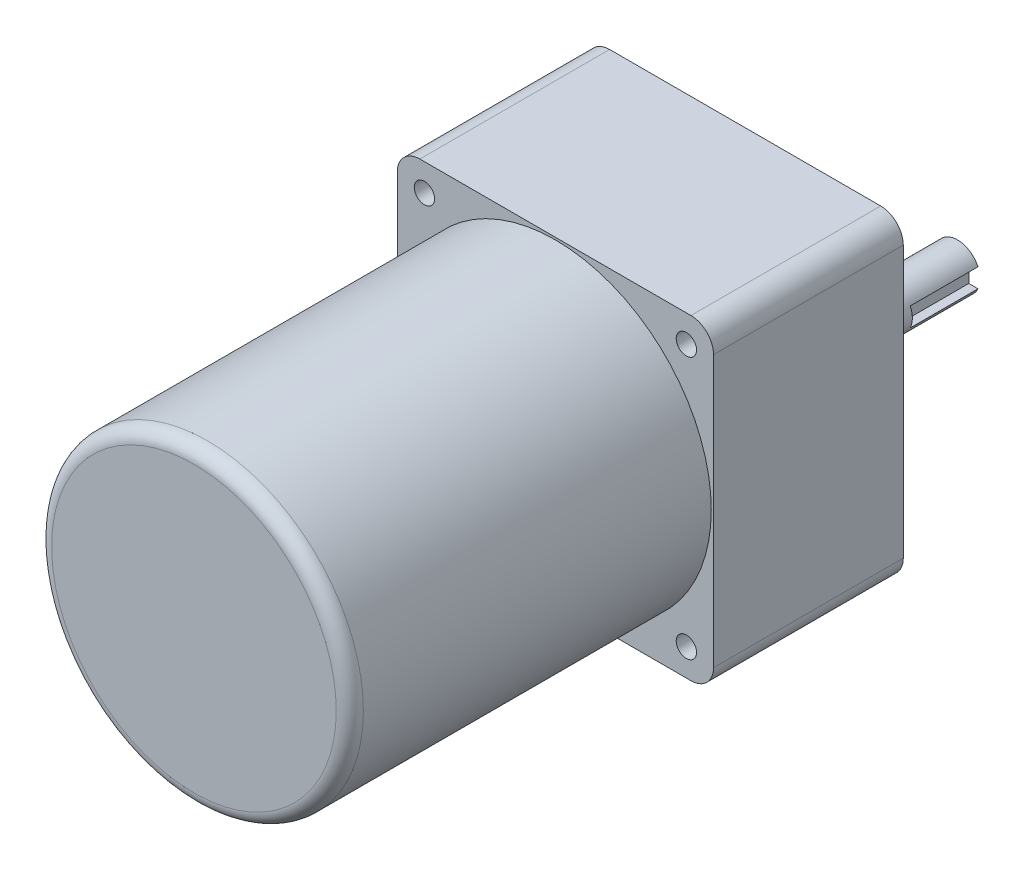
SolidWorks part; units mm, degrees
ref_plane "前基準面" through (0, 0, 0) normal (0, 0, 1) x (1, 0, 0)
ref_plane "上基準面" through (0, 0, 0) normal (0, 1, 0) x (1, 0, 0)
ref_plane "右基準面" through (0, 0, 0) normal (1, 0, 0) x (0, 0, -1)
sketch "草圖1" plane through (0, 0, 0) normal (0, 0, 1) x (1, 0, 0)
  line L1 (-35, -30) -> (-35, 30)
  line L2 (35, -30) -> (35, 30)
  line L3 (30, 35) -> (-30, 35)
  line L11 (30, -35) -> (-30, -35)
  arc A0 (-30, 35) -> (-35, 30) centre (-30, 30) ccw
  arc A1 (35, 30) -> (30, 35) centre (30, 30) ccw
  circle A2 centre (28.9914, 28.9914) radius 2.25
  circle A4 centre (-28.9914, 28.9914) radius 2.25
  arc A7 (30, -35) -> (35, -30) centre (30, -30) ccw
  arc A8 (-35, -30) -> (-30, -35) centre (-30, -30) ccw
  circle A9 centre (-28.9914, -28.9914) radius 2.25
  circle A11 centre (28.9914, -28.9914) radius 2.25
extrude "填料-伸長1" add sketch "草圖1" along normal blind 42
sketch "草圖2" plane through (0, 0, 42) normal (0, 0, 1) x (1, 0, 0)
  line L0 (-35, 0) -> (35, 0) construction
  line L1 (-35, 30) -> (-35, -30) construction
  line L2 (35, -30) -> (35, 30) construction
  line L3 (0, 35) -> (0, -35) construction
  line L4 (30, 35) -> (-30, 35) construction
  line L5 (-30, -35) -> (30, -35) construction
  circle A0 centre (0, 0) radius 34.5
  dimension "D1" = 69
extrude "填料-伸長2" add sketch "草圖2" along normal blind 80
fillet "圓角1" radius 3 1 edges at (34.5, 0, 122)
sketch "草圖3" plane through (0, 0, 0) normal (0, 0, -1) x (-1, 0, 0)
  line L0 (-35, 0) -> (35, 0) construction
  line L1 (-35, -30) -> (-35, 30) construction
  line L2 (35, 30) -> (35, -30) construction
  circle A0 centre (-15, 0) radius 15
  dimension "D1" = 30
  dimension "D2" = 20
extrude "填料-伸長3" add sketch "草圖3" along normal blind 3
sketch "草圖4" plane through (0, 0, -3) normal (0, 0, -1) x (-1, 0, 0)
  circle A0 centre (-15, 0) radius 5
  dimension "D1" = 10
extrude "填料-伸長4" add sketch "草圖4" along normal blind 29
fillet "圓角2" radius 0.5 1 edges at (0, 0, -3)
sketch "草圖5" plane through (0, 0, -32) normal (0, 0, -1) x (-1, 0, 0)
  line L0 (-17.5, -2.1047) -> (-17.5, 2.1047)
  line L1 (-20, 0) -> (-10, 0) construction
  line L2 (-17.5, -2.1047) -> (-19.5354, -2.1047)
  line L3 (-17.5, 2.1047) -> (-19.5354, 2.1047)
  circle A0 centre (-15, 0) radius 5 construction
  arc A1 (-19.5354, 2.1047) -> (-19.5354, -2.1047) centre (-15, 0) ccw
  dimension "D1" = 2.5
extrude "除料-伸長1" cut sketch "草圖5" against normal blind 15
